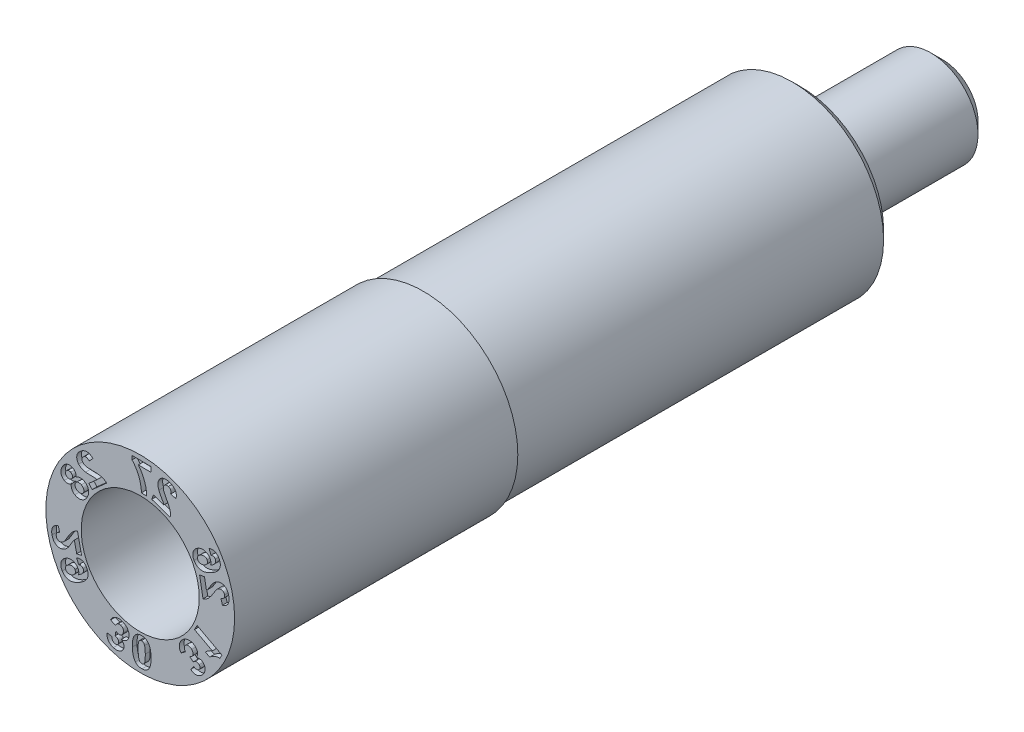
SolidWorks part; units mm, degrees
other "<M2 X .4 SHSS>-<Revolve1>"
ref_plane "Front Plane" through (0, 0, 0) normal (0, 0, 1) x (1, 0, 0)
ref_plane "Top Plane" through (0, 0, 0) normal (0, 1, 0) x (1, 0, 0)
ref_plane "Right Plane" through (0, 0, 0) normal (1, 0, 0) x (0, 0, -1)
sketch "Sketch1" plane through (0, 0, 0) normal (1, 0, 0) x (0, 0, -1)
  line L2 (0, 2) -> (0, 1.25)
  line L3 (13.75, 2) -> (0, 2)
  line L4 (-3.7979, 0) -> (49996.2021, 0) construction
  line L8 (11, 0.7) -> (2.3, 0.7)
  line L9 (2.3, 1.25) -> (2.3, 0.7)
  line L10 (2.3, 1.25) -> (0, 1.25)
  line L12 (14, 1) -> (14, 1.75)
  line L16 (14, 1.75) -> (13.75, 2)
  line L17 (14, 1) -> (11, 1)
  line L18 (11, 0.7) -> (11, 1)
  dimension "D1" = 14
  dimension "D2" = 45
  dimension "D3" = 0.25
  dimension "D4" = 4
  dimension "D5" = 2.5
  dimension "D6" = 2.3
  dimension "D7" = 1.4
  dimension "D8" = 2
  dimension "D9" = 3
revolve "Revolve1" add sketch "Sketch1" angle 360 about L4
sketch "Sketch5" plane through (0, 0, 0) normal (1, 0, 0) x (0, 0, -1)
  line L0 (0, 0) -> (50000, 0) construction
  line L1 (0, 2) -> (0, -2) construction
  line L2 (6, 1.935) -> (14, 1.935)
  line L3 (6, 1.935) -> (6, 2.935)
  line L4 (6, 2.935) -> (14, 2.935)
  line L5 (14, 1.935) -> (14, 2.935)
  line L6 (14, -1.75) -> (14, 1.75) construction
  line L7 (13.75, 2) -> (0, 2) construction
  dimension "D1" = 6
  dimension "D2" = 0.065
  dimension "D3" = 1
revolve "Cut-Revolve1" cut sketch "Sketch5" angle 360 about L0
sketch "Sketch2" plane through (0, 0, 0) normal (0, 0, 1) x (1, 0, 0)
  line L0 (0, 0) -> (0, 2.3112) construction
  line L1 (0, 0) -> (2.0015, 1.1556) construction
  line L2 (0, 0) -> (2.0015, -1.1556) construction
  line L3 (0, 0) -> (0, -2.3112) construction
  line L4 (0, 0) -> (-2.0015, -1.1556) construction
  line L5 (0, 0) -> (-2.0015, 1.1556) construction
  circle A0 centre (0, 0) radius 1.3343 construction
  text T0 "26   27   28   29   30   31" font "Arial" height 0.6
  point P10 (0, 0)
  point P746 (4, 0.001)
  point P747 (0.0034, 0.0034)
  point P748 (0.0034, 0)
  dimension "D1" = 6
extrude "Cut-Extrude1" cut sketch "Sketch2" against normal blind 0.1
sketch "Sketch3" plane through (0, 0, -2.3) normal (0, 0, 1) x (1, 0, 0)
  line L0 (0, 0) -> (0, 50000) construction
  line L1 (0.4041, 0.7) -> (-0.4041, 0.7)
  line L2 (-0.4041, 0.7) -> (-0.8083, 0)
  line L3 (-0.8083, 0) -> (-0.4041, -0.7)
  line L4 (-0.4041, -0.7) -> (0.4041, -0.7)
  line L5 (0.4041, -0.7) -> (0.8083, 0)
  line L6 (0.8083, 0) -> (0.4041, 0.7)
  line L7 (0, 0) -> (50000, 0) construction
  circle A0 centre (0, 0) radius 0.7 construction
  circle A1 centre (0, 0) radius 0.7 construction
extrude "Cut-Extrude2" cut sketch "Sketch3" against normal blind 1.4
inserted part "M2 X .4 SHSS"
move or copy body "Body-Move/Copy2" placed by mates yes
